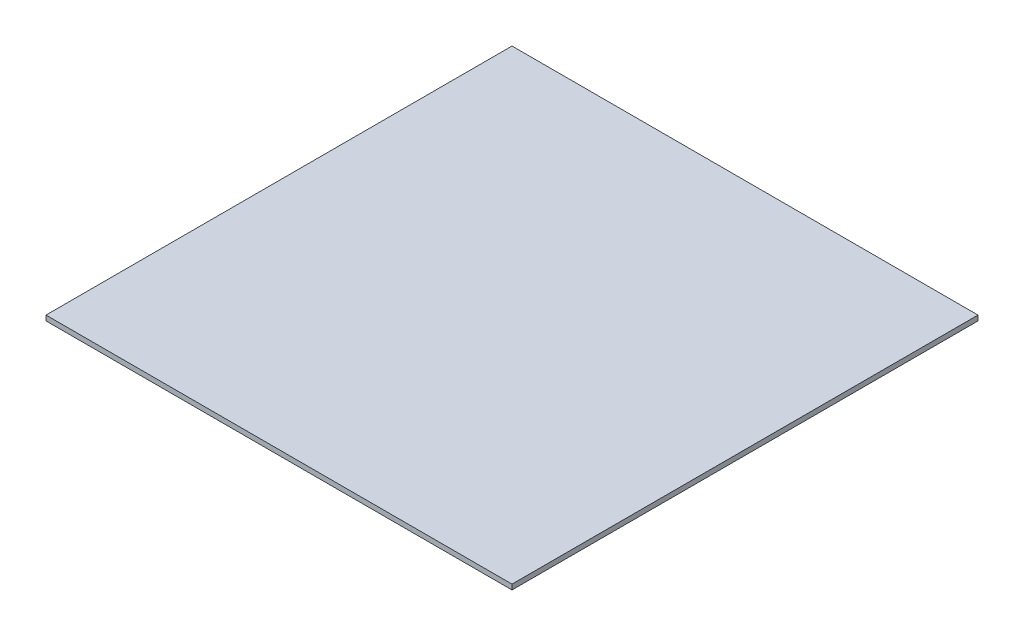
SolidWorks part; units mm, degrees
ref_plane "Front Plane" through (0, 0, 0) normal (0, 0, 1) x (1, 0, 0)
ref_plane "Top Plane" through (0, 0, 0) normal (0, 1, 0) x (1, 0, 0)
ref_plane "Right Plane" through (0, 0, 0) normal (1, 0, 0) x (0, 0, -1)
sketch "Sketch1" plane through (0, 0, 0) normal (0, 1, 0) x (1, 0, 0)
  line L0 (-228.6, -228.6) -> (228.6, 228.6) construction
  line L1 (-228.6, -228.6) -> (228.6, -228.6)
  line L2 (-228.6, -228.6) -> (-228.6, 228.6)
  line L3 (-228.6, 228.6) -> (228.6, 228.6)
  line L4 (228.6, -228.6) -> (228.6, 228.6)
  dimension "D1" = 457.2
  dimension "D2" = 457.2
extrude "Extrude1" add sketch "Sketch1" against normal blind 5
